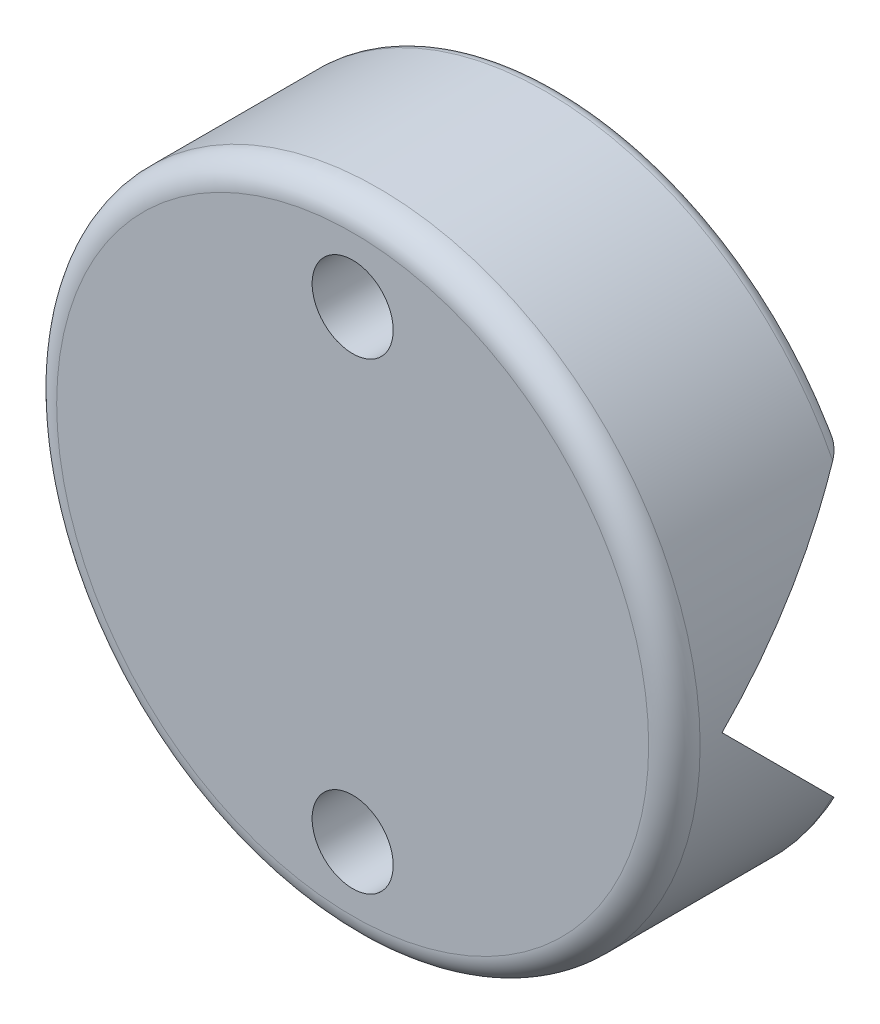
SolidWorks part; units mm, degrees
ref_plane "Plan1" through (0, 0, 0) normal (0, 0, 1) x (1, 0, 0)
ref_plane "Plan2" through (0, 0, 0) normal (0, 1, 0) x (1, 0, 0)
ref_plane "Plan3" through (0, 0, 0) normal (1, 0, 0) x (0, 0, -1)
sketch "Esquisse1" plane through (0, 0, 0) normal (0, 0, 1) x (1, 0, 0)
  circle A0 centre (0, 0) radius 25
  dimension "D1" = 50
extrude "Base-Extrusion" add sketch "Esquisse1" along normal blind 16
sketch "Esquisse6" plane through (0, 0, 16) normal (0, 0, 1) x (1, 0, 0)
  circle A0 centre (0, 18) radius 3.15
  circle A1 centre (0, -18) radius 3.15
  dimension "D3" = 6.3
  dimension "D4" = 6.3
  dimension "D1" = 18
  dimension "D2" = 18
extrude "Enlèv. mat.-Extru.6" cut sketch "Esquisse6" against normal through all
sketch "Esquisse18" plane through (0, 0, 0) normal (1, 0, 0) x (0, 0, -1)
  line L0 (0, 12.3) -> (0, -12.3)
  line L8 (0, 12.3) -> (-12.3, 0)
  line L10 (0, -12.3) -> (-12.3, 0)
extrude "Enlèv. mat.-Extru.17" cut sketch "Esquisse18" against normal through all
sketch "Esquisse19" plane through (0, 0, 0) normal (-1, 0, 0) x (0, 0, 1)
  line L0 (0, 12.3) -> (12.3, 0)
  line L1 (12.3, 0) -> (0, -12.3)
  line L2 (0, -12.3) -> (0, 12.3)
extrude "Enlèv. mat.-Extru.18" cut sketch "Esquisse19" against normal through all
fillet "Congé1" radius 2
fillet "Congé2" radius 1
